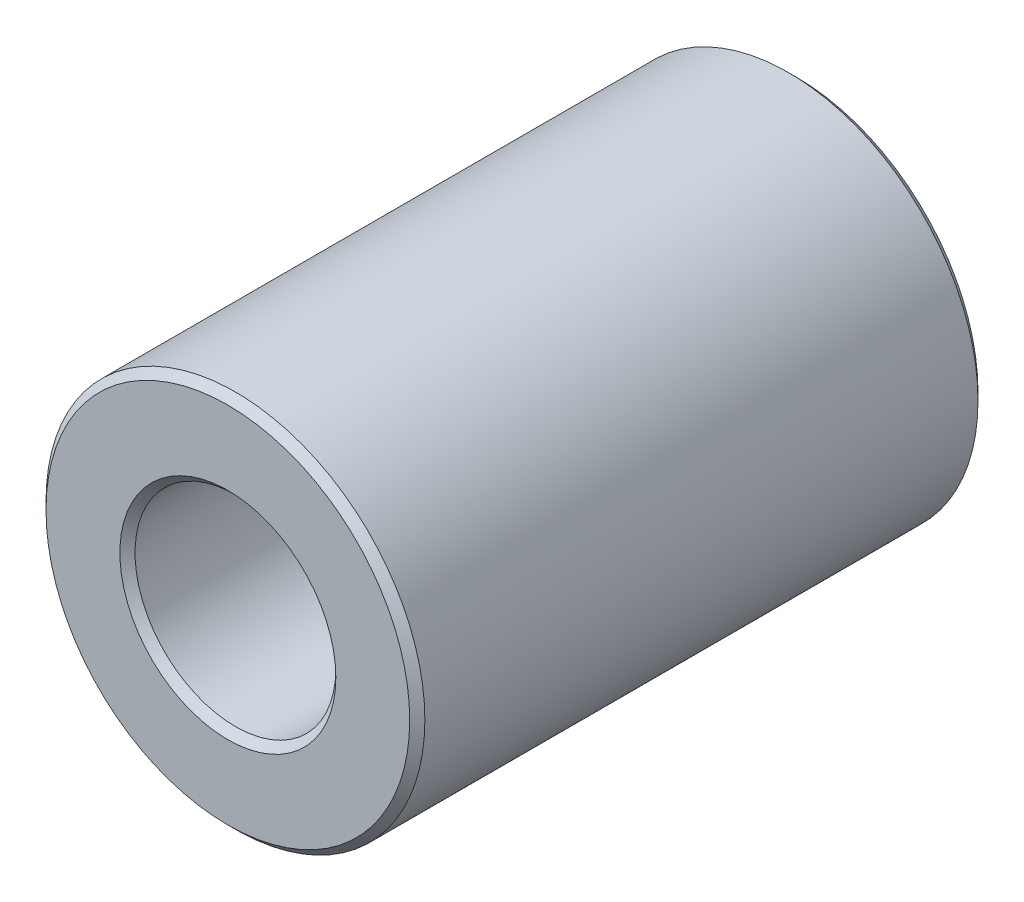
SolidWorks part; units mm, degrees
ref_plane "Front Plane" through (0, 0, 0) normal (0, 0, 1) x (1, 0, 0)
ref_plane "Top Plane" through (0, 0, 0) normal (0, 1, 0) x (1, 0, 0)
ref_plane "Right Plane" through (0, 0, 0) normal (1, 0, 0) x (0, 0, -1)
sketch "Sketch1" plane through (0, 0, 0) normal (0, 0, 1) x (1, 0, 0)
  circle A0 centre (0, 0) radius 5
  circle A1 centre (0, 0) radius 2.65
  dimension "D1" = 10
  dimension "D2" = 5.3
extrude "Boss-Extrude2" add sketch "Sketch1" along normal mid plane 15
chamfer "Chamfer3" distance 0.2 angle 45 4 edges at (5, 0, 7.5) (5, 0, -7.5) (2.65, 0, -7.5) (2.65, 0, 7.5)
